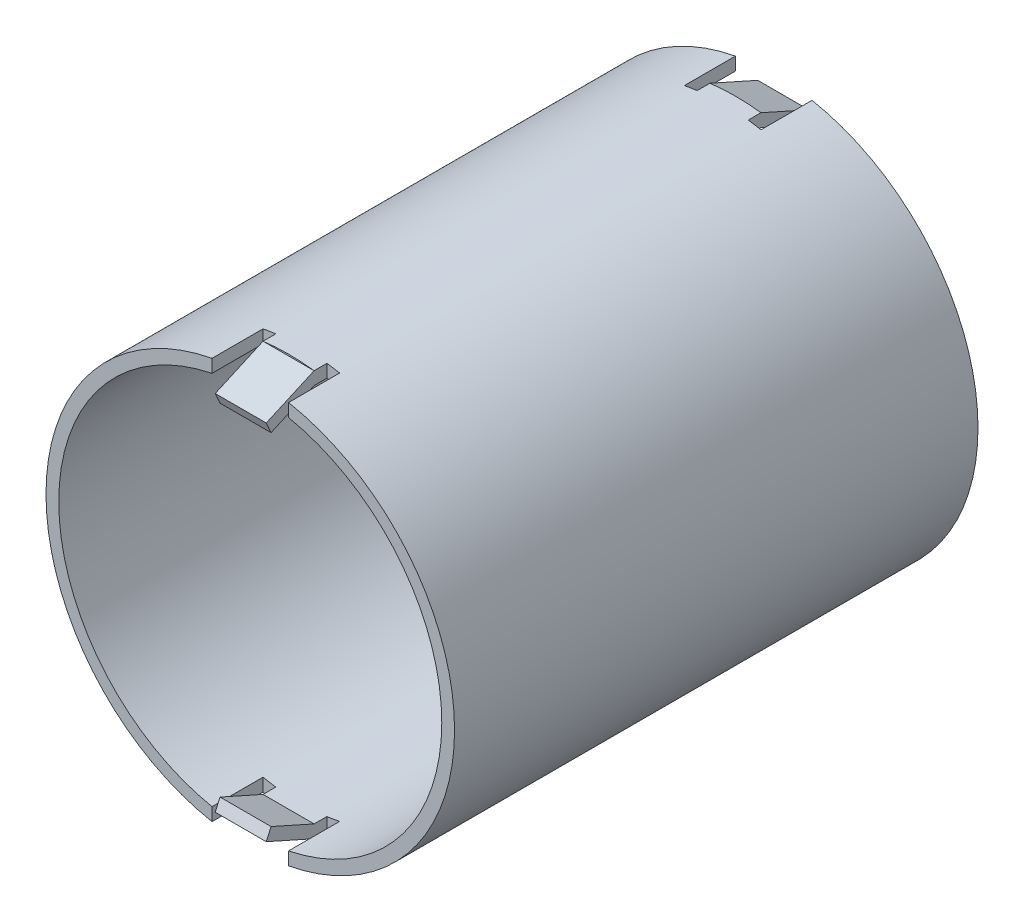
SolidWorks part; units mm, degrees
ref_plane "FACE" through (0, 0, 0) normal (0, 0, 1) x (1, 0, 0)
ref_plane "DESSUS" through (0, 0, 0) normal (0, 1, 0) x (1, 0, 0)
ref_plane "GAUCHE" through (0, 0, 0) normal (1, 0, 0) x (0, 0, -1)
sketch "Esquisse1" plane through (0, 0, 0) normal (0, 0, 1) x (1, 0, 0)
  circle A0 centre (0, 0) radius 16
  circle A1 centre (0, 0) radius 15
  dimension "D1" = 32
  dimension "D2" = 30
extrude "Base-Extrusion" add sketch "Esquisse1" along normal blind 41
sketch "Esquisse3" plane through (0, 0, 0) normal (0, 1, 0) x (1, 0, 0)
  line L0 (15, 0) -> (-15, 0) construction
  line L1 (3, 0) -> (-3, 0)
  line L2 (-3, 0) -> (-3, -4)
  line L3 (-3, -4) -> (-2, -4)
  line L4 (-2, -4) -> (-2, -3)
  line L5 (-2, -3) -> (2, -3)
  line L6 (2, -3) -> (2, -4)
  line L7 (2, -4) -> (3, -4)
  line L8 (3, -4) -> (3, 0)
  line L9 (0, -41) -> (0, 0) construction
  dimension "D1" = 4
  dimension "D2" = 2
  dimension "D3" = 4
  dimension "D4" = 1
  dimension "D5" = 6
  dimension "D6" = 3
extrude "Enlèv. mat.-Extru.1" cut sketch "Esquisse3" against normal through all and the other way through all
ref_plane "Plan1" through (0, 0, 20.5) normal (0, 0, -1) x (-1, 0, 0)
mirror "Symétrie1" about plane through (0, 0, 20.5) normal (0, 0, -1)
sketch "Esquisse5" plane through (2, 0, 0) normal (1, 0, 0) x (0, 0, -1)
  line L0 (-3, 14.8661) -> (-3, 15.8745) construction
  line L1 (-3, 14.8661) -> (-3, 15.8745)
  line L2 (-3, 15.8745) -> (0.747, 14.2009)
  line L3 (0.747, 14.2009) -> (0.3714, 13.3601)
  line L4 (0.3714, 13.3601) -> (-3, 14.8661)
extrude "Boss.-Extru.1" add sketch "Esquisse5" against normal blind 4
pattern_circular "Répétition circulaire1" count 2 every 180
mirror "Symétrie2" about plane through (0, 0, 20.5) normal (0, 0, -1)
